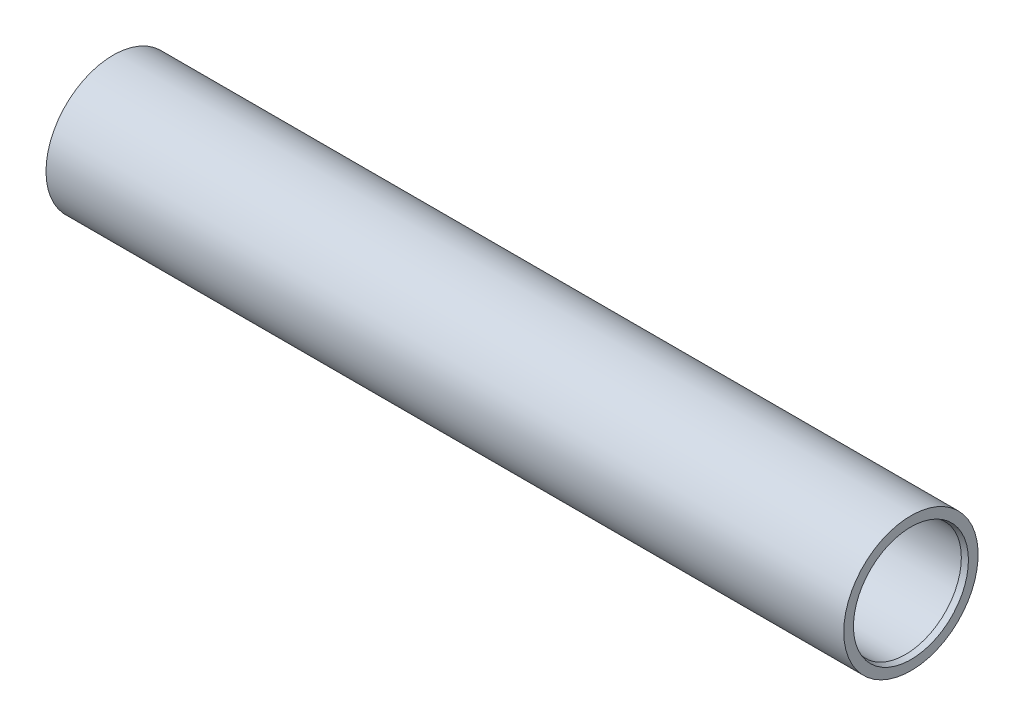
SolidWorks part; units mm, degrees
ref_plane "Plan1" through (0, 0, 0) normal (0, 0, 1) x (1, 0, 0)
ref_plane "Plan2" through (0, 0, 0) normal (0, 1, 0) x (1, 0, 0)
ref_plane "Plan3" through (0, 0, 0) normal (1, 0, 0) x (0, 0, -1)
sketch "Esquisse1" plane through (0, 0, 0) normal (0, 0, 1) x (1, 0, 0)
  line L0 (-105, 0) -> (106, 0) construction
  line L1 (-92, 20) -> (-92, 24)
  line L2 (-92, 24) -> (193, 24)
  line L3 (193, 24) -> (193, 20)
  line L4 (193, 20) -> (-92, 20)
  dimension "D1" = 285
  dimension "D2" = 24
  dimension "D3" = 20
revolve "Base-Révolution" add sketch "Esquisse1" angle 360 about L0
chamfer "Chanfrein1" distance 2 angle 15
chamfer "Chanfrein2" distance 2 angle 15
